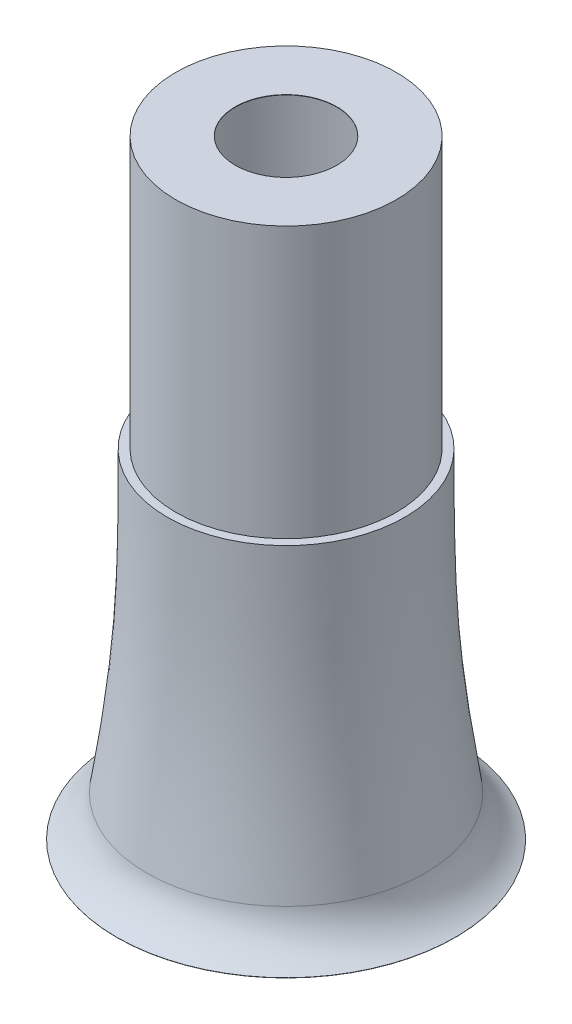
SolidWorks part; units mm, degrees
ref_plane "Plan de face" through (0, 0, 0) normal (0, 0, 1) x (1, 0, 0)
ref_plane "Plan de dessus" through (0, 0, 0) normal (0, 1, 0) x (1, 0, 0)
ref_plane "Plan de droite" through (0, 0, 0) normal (1, 0, 0) x (0, 0, -1)
sketch "Esquisse1" plane through (0, 0, 0) normal (1, 0, 0) x (0, 0, -1)
  line L0 (0, 0) -> (0, 180) construction
  line L1 (0, 55) -> (0, -55) construction
  line L2 (-15, 180) -> (-32.5, 180)
  line L3 (-32.5, 180) -> (-32.5, 100)
  line L4 (-32.5, 100) -> (-35, 100)
  line L5 (-35, 100) -> (-35, 114.3202) construction
  line L7 (-50, 0) -> (0, 0) construction
  arc A0 (-41, 12) -> (-50, 0) centre (-56.8066, 14.48) cw
  spline S0 degree 3 poles (-35, 100) (-35, 63.9133) (-35.4066, 47.6506) (-41, 12) knots 0 0 0 0 1 1 1 1
  dimension "D8" = 12
  dimension "D9" = 16
  dimension "D1" = 180
  dimension "D2" = 65
  dimension "D3" = 30
  dimension "D4" = 70
  dimension "D5" = 82
  dimension "D7" = 100
  dimension "D10" = 100
revolve "Révol.-Mince2" add sketch "Esquisse1" angle 360 about L0
